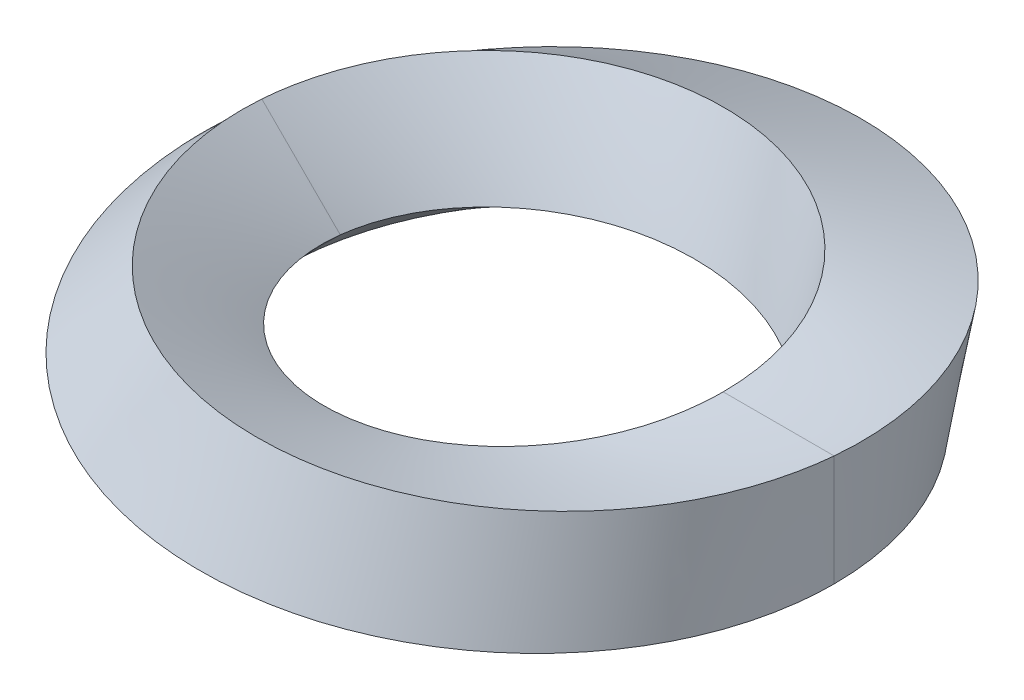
SolidWorks part; units mm, degrees
ref_plane "Plane1" through (0, 0, 0) normal (0, 0, 1) x (1, 0, 0)
ref_plane "Plane2" through (0, 0, 0) normal (0, 1, 0) x (1, 0, 0)
ref_plane "Plane3" through (0, 0, 0) normal (1, 0, 0) x (0, 0, -1)
sketch "Sketch1" plane through (0, 0, 0) normal (0, 1, 0) x (1, 0, 0)
  line L0 (-86.5044, 0) -> (86.5044, 0) construction
  arc A0 (86.5044, 0) -> (-86.5044, 0) centre (0, 0) ccw
  arc A1 (-86.5044, 0) -> (86.5044, 0) centre (0, 0) ccw construction
sketch "Sketch2" plane through (0, 0, 0) normal (0, 0, 1) x (1, 0, 0)
  line L0 (67.9377, -18.5667) -> (105.0711, 18.5667) construction
  line L1 (67.9377, 18.5667) -> (105.0711, 18.5667)
  line L2 (67.9377, 18.5667) -> (67.9377, -18.5667)
  line L3 (67.9377, -18.5667) -> (105.0711, -18.5667)
  line L4 (105.0711, 18.5667) -> (105.0711, -18.5667)
  point P4 (86.5044, 0)
sweep "Sweep1" add profiles "Sketch2" path "Sketch1" parameters "D1"=45
sketch "Sketch3" plane through (0, 0, 0) normal (0, 1, 0) x (1, 0, 0)
  arc A0 (-86.5044, 0) -> (86.5044, 0) centre (0, 0) ccw construction
  arc A1 (-86.5044, 0) -> (86.5044, 0) centre (0, 0) ccw
sketch "Sketch4" plane through (0, 0, 0) normal (0, 0, 1) x (1, 0, 0)
  line L4 (67.9377, 18.5667) -> (67.9377, -18.5667)
  line L5 (67.9377, -18.5667) -> (105.0711, -18.5667)
  line L6 (105.0711, -18.5667) -> (105.0711, 18.5667)
  line L7 (105.0711, 18.5667) -> (67.9377, 18.5667)
  line L8 (67.9377, 18.5667) -> (67.9377, -18.5667)
  line L9 (67.9377, -18.5667) -> (105.0711, -18.5667)
  line L10 (105.0711, -18.5667) -> (105.0711, 18.5667)
  line L11 (105.0711, 18.5667) -> (67.9377, 18.5667)
  dimension "D1" = 0
sweep "Sweep2" add profiles "Sketch4" path "Sketch3" parameters "D1"=45
